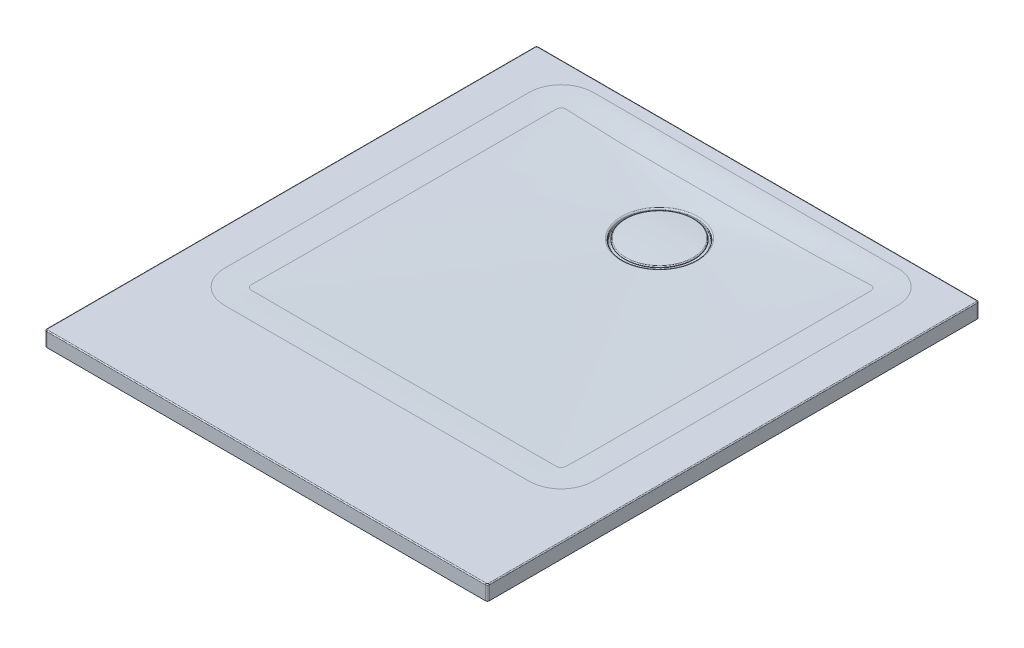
SolidWorks part; units mm, degrees
ref_plane "Płaszczyzna przednia" through (0, 0, 0) normal (0, 0, 1) x (1, 0, 0)
ref_plane "Płaszczyzna górna" through (0, 0, 0) normal (0, 1, 0) x (1, 0, 0)
ref_plane "Płaszczyzna prawa" through (0, 0, 0) normal (1, 0, 0) x (0, 0, -1)
sketch "Szkic2" plane through (0, 0, 0) normal (0, 1, 0) x (1, 0, 0)
  line L0 (0, 500) -> (0, 300) construction
  line L1 (-450, -500) -> (450, -500)
  line L2 (-450, -500) -> (-450, 500)
  line L3 (-450, 500) -> (450, 500)
  line L4 (450, -500) -> (450, 500)
  line L5 (-450, -500) -> (450, 500) construction
  line L6 (-450, 500) -> (450, -500) construction
  line L7 (-360, 460) -> (360, 460)
  line L8 (-360, 460) -> (-360, -260)
  line L9 (-360, -260) -> (360, -260)
  line L10 (360, 460) -> (360, -260)
  line L11 (-400, 500) -> (-400, -300) construction
  line L12 (-400, -300) -> (400, -300) construction
  line L13 (400, -300) -> (400, 500) construction
  circle A0 centre (0, 300) radius 75
  point P0 (0, 0)
  point P11 (0, 460)
  point P16 (0, -300)
  dimension "D9" = 150
  dimension "D1" = 900
  dimension "D2" = 1000
  dimension "D3" = 40
  dimension "D4" = 90
  dimension "D5" = 40
  dimension "D6" = 50
  dimension "D7" = 800
  dimension "D8" = 200
  dimension "D10" = 800
sketch "Szkic3" plane through (0, 0, 0) normal (0, 1, 0) x (1, 0, 0)
  line L0 (-450, -500) -> (-450, 500) construction
  line L1 (-450, -500) -> (450, -500) construction
  line L2 (450, -500) -> (450, 500) construction
  line L3 (-450, 500) -> (450, 500) construction
  line L4 (-360, 460) -> (-360, -260) construction
  line L5 (-360, 460) -> (360, 460) construction
  line L6 (360, 460) -> (360, -260) construction
  line L7 (-360, -260) -> (360, -260) construction
  line L8 (-450, -500) -> (-450, 500)
  line L9 (-450, -500) -> (450, -500)
  line L10 (450, -500) -> (450, 500)
  line L11 (-450, 500) -> (450, 500)
  line L12 (-360, 410) -> (-360, -210)
  line L13 (-310, 460) -> (310, 460)
  line L14 (360, 410) -> (360, -210)
  line L15 (-310, -260) -> (310, -260)
  arc A0 (360, 410) -> (310, 460) centre (310, 410) ccw
  arc A1 (-310, 460) -> (-360, 410) centre (-310, 410) ccw
  arc A2 (310, -260) -> (360, -210) centre (310, -210) ccw
  arc A3 (-310, -260) -> (-360, -210) centre (-310, -210) cw
  dimension "D1" = 50
surface "Powierzchnia-Płaszczyzna1" sketch "Szkic3"
sketch "Szkic4" plane through (0, 0, 0) normal (0, 1, 0) x (1, 0, 0)
  line L0 (-360, 460) -> (-360, -260) construction
  line L1 (-360, -260) -> (360, -260) construction
  line L2 (360, 460) -> (360, -260) construction
  line L3 (-360, 460) -> (360, 460) construction
  line L4 (-360, 460) -> (-360, -260)
  line L5 (-360, -260) -> (360, -260)
  line L6 (360, 460) -> (360, -260)
  line L7 (-360, 460) -> (360, 460)
ref_plane "korek" through (0, -15, 0) normal (0, 1, 0) x (-1, 0, 0)
sketch "Szkic5" plane through (0, -15, 0) normal (0, 1, 0) x (-1, 0, 0)
  circle A0 centre (0, -300) radius 75 construction
  circle A1 centre (0, -300) radius 75
surface "Powierzchnia-Wyciągnięcie po profilach2"
surface "Powierzchnia-Połącz1"
sketch "Szkic7" plane through (0, 0, 0) normal (0, 1, 0) x (1, 0, 0)
  line L27 (310, 420) -> (-310, 420)
  line L28 (-320, 410) -> (-320, -210)
  line L29 (-310, -220) -> (310, -220)
  line L30 (320, -210) -> (320, 410)
  line L31 (310, 420) -> (-310, 420)
  line L32 (-320, 410) -> (-320, -210)
  line L33 (-310, -220) -> (310, -220)
  line L34 (320, -210) -> (320, 410)
  line L35 (310, 475) -> (-310, 475)
  line L36 (-375, 410) -> (-375, -210)
  line L37 (-310, -275) -> (310, -275)
  line L38 (375, -210) -> (375, 410)
  line L39 (310, 475) -> (-310, 475)
  line L40 (-375, 410) -> (-375, -210)
  line L41 (-310, -275) -> (310, -275)
  line L42 (375, -210) -> (375, 410)
  arc A0 (320, -210) -> (310, -220) centre (310, -210) cw
  arc A1 (-320, -210) -> (-310, -220) centre (-310, -210) ccw
  arc A2 (320, 410) -> (310, 420) centre (310, 410) ccw
  arc A3 (-320, 410) -> (-310, 420) centre (-310, 410) cw
  spline S23 degree 3 poles (-642.4276, 138.4615) (143.2601, 308.8094) (326.8324, 376.6094) (319.7449, 412.2677) (319.6659, 412.5844) (319.4756, 413.2123) (319.364, 413.5244) (318.988, 414.4324) (318.6811, 415.0065) (318.1374, 415.8215) (317.9415, 416.0862) (317.5236, 416.5958) (317.3038, 416.8383) (316.6124, 417.53) (316.1095, 417.944) (315.2903, 418.4923) (315.0066, 418.6627) (314.4297, 418.9712) (314.1353, 419.1108) (313.5342, 419.3603) (313.2277, 419.4705) (312.6023, 419.661) (312.2821, 419.7415) (258.0026, 430.6172) (153.6608, -12.3452) (39.61, -542.7472) knots -6.791093 -6.791093 -6.791093 -6.791093 0.125 0.125 0.1875 0.1875 0.25 0.25 0.375 0.375 0.4375 0.4375 0.5 0.5 0.625 0.625 0.6875 0.6875 0.75 0.75 0.8125 0.8125 0.875 0.875 11.317642 11.317642 11.317642 11.317642 only from (320, 410) to (310, 420)
  spline S24 degree 3 poles (-31.4291, -540.4134) (-199.2409, 215.8714) (-274.2436, 427.3191) (-312.2675, 419.7448) (-312.5843, 419.6659) (-313.2122, 419.4758) (-313.5242, 419.3641) (-314.4322, 418.9882) (-315.0062, 418.6811) (-315.8212, 418.1376) (-316.0859, 417.9416) (-316.5956, 417.5238) (-316.838, 417.304) (-317.5298, 416.6127) (-317.9438, 416.1098) (-318.4921, 415.2908) (-318.6624, 415.007) (-318.9711, 414.4301) (-319.1106, 414.1356) (-319.3602, 413.5345) (-319.4703, 413.2278) (-319.6609, 412.6025) (-319.7416, 412.2823) (-328.6821, 367.5611) (-33.1297, 289.3562) (650.2866, 168.0792) knots -7.255081 -7.255081 -7.255081 -7.255081 0.125 0.125 0.1875 0.1875 0.25 0.25 0.375 0.375 0.4375 0.4375 0.5 0.5 0.625 0.625 0.6875 0.6875 0.75 0.75 0.8125 0.8125 0.875 0.875 9.466633 9.466633 9.466633 9.466633 only from (-310, 420) to (-320, 410)
  spline S25 degree 3 poles (642.4251, 61.5379) (-143.2606, -108.8096) (-326.8324, -176.6094) (-319.7449, -212.2677) (-319.6659, -212.5844) (-319.4756, -213.2123) (-319.364, -213.5244) (-318.988, -214.4324) (-318.6811, -215.0065) (-318.1374, -215.8215) (-317.9415, -216.0862) (-317.5236, -216.5958) (-317.3038, -216.8383) (-316.6124, -217.53) (-316.1095, -217.944) (-315.2903, -218.4923) (-315.0066, -218.6627) (-314.4297, -218.9712) (-314.1353, -219.1108) (-313.5342, -219.3603) (-313.2277, -219.4705) (-312.6023, -219.661) (-312.2821, -219.7415) (-258.0027, -230.6172) (-153.661, 212.3443) (-39.6103, 742.7457) knots -6.791085 -6.791085 -6.791085 -6.791085 0.125 0.125 0.1875 0.1875 0.25 0.25 0.375 0.375 0.4375 0.4375 0.5 0.5 0.625 0.625 0.6875 0.6875 0.75 0.75 0.8125 0.8125 0.875 0.875 11.317632 11.317632 11.317632 11.317632 only from (-320, -210) to (-310, -220)
  spline S26 degree 3 poles (31.4291, 740.4136) (199.2409, -15.8714) (274.2436, -227.3191) (312.2675, -219.7448) (312.5843, -219.6659) (313.2122, -219.4758) (313.5242, -219.3641) (314.4322, -218.9882) (315.0062, -218.6811) (315.8212, -218.1376) (316.0859, -217.9416) (316.5956, -217.5238) (316.838, -217.304) (317.5298, -216.6127) (317.9438, -216.1098) (318.4921, -215.2908) (318.6624, -215.007) (318.9711, -214.4301) (319.1106, -214.1356) (319.3602, -213.5345) (319.4703, -213.2278) (319.6609, -212.6025) (319.7416, -212.2823) (328.6821, -167.5611) (33.1297, -89.3562) (-650.2867, 31.9209) knots -7.255081 -7.255081 -7.255081 -7.255081 0.125 0.125 0.1875 0.1875 0.25 0.25 0.375 0.375 0.4375 0.4375 0.5 0.5 0.625 0.625 0.6875 0.6875 0.75 0.75 0.8125 0.8125 0.875 0.875 9.466633 9.466633 9.466633 9.466633 only from (310, -220) to (320, -210)
  spline S31 degree 3 poles (-2447.3279, -564.9037) (-187.9384, -11.1134) (406.24, 259.1285) (373.3422, 424.7391) (372.8283, 426.7975) (371.9013, 429.8585) (371.5657, 430.8761) (370.8439, 432.8947) (370.4595, 433.8909) (368.4227, 438.8085) (366.4282, 442.5403) (363.4834, 446.9548) (362.8716, 447.825) (361.6017, 449.5398) (360.9418, 450.3866) (358.9049, 452.8707) (357.4759, 454.4469) (352.9823, 458.9436) (349.7133, 461.6344) (345.2769, 464.6047) (344.3695, 465.1805) (342.535, 466.2817) (341.6076, 466.8075) (338.7954, 468.3123) (336.881, 469.219) (332.9737, 470.8414) (330.9809, 471.5575) (327.9321, 472.4866) (326.9059, 472.7721) (324.8332, 473.2939) (323.7848, 473.5304) (320.636, 474.1598) (318.525, 474.4739) (157.1945, 490.4271) (-66.7497, -76.4225) (-486.2095, -2402.8106) knots -4.799088 -4.799088 -4.799088 -4.799088 0.125 0.125 0.1875 0.1875 0.21875 0.21875 0.25 0.25 0.375 0.375 0.40625 0.40625 0.4375 0.4375 0.5 0.5 0.625 0.625 0.65625 0.65625 0.6875 0.6875 0.75 0.75 0.8125 0.8125 0.84375 0.84375 0.875 0.875 0.9375 0.9375 5.625508 5.625508 5.625508 5.625508 only from (375, 410) to (310, 475)
  spline S32 degree 3 poles (607.9599, -2368.1366) (53.2635, 27.3408) (-172.0764, 488.9143) (-318.4946, 474.4775) (-320.5876, 474.167) (-324.7389, 473.3421) (-326.7973, 472.8284) (-329.8583, 471.9015) (-330.8758, 471.5658) (-332.8944, 470.844) (-333.8907, 470.4596) (-338.8083, 468.4228) (-342.54, 466.4283) (-346.9545, 463.4835) (-347.8248, 462.8718) (-349.5396, 461.6019) (-350.3863, 460.9421) (-352.8705, 458.9052) (-354.4466, 457.4761) (-358.9434, 452.9826) (-361.6341, 449.7136) (-364.6045, 445.2774) (-365.1802, 444.3699) (-366.2814, 442.5354) (-366.8073, 441.6079) (-368.3122, 438.7958) (-369.2188, 436.8813) (-370.8414, 432.9739) (-371.5573, 430.9811) (-372.4865, 427.9323) (-372.7721, 426.9061) (-373.2939, 424.8334) (-373.5304, 423.785) (-412.5492, 228.5137) (443.2833, -65.1095) (2470.5411, -488.8872) knots -4.211101 -4.211101 -4.211101 -4.211101 0.0625 0.0625 0.125 0.125 0.1875 0.1875 0.21875 0.21875 0.25 0.25 0.375 0.375 0.40625 0.40625 0.4375 0.4375 0.5 0.5 0.625 0.625 0.65625 0.65625 0.6875 0.6875 0.75 0.75 0.8125 0.8125 0.84375 0.84375 0.875 0.875 6.657374 6.657374 6.657374 6.657374 only from (-310, 475) to (-375, 410)
  spline S33 degree 3 poles (2447.3279, 764.9037) (187.9384, 211.1134) (-406.24, -59.1285) (-373.3422, -224.7391) (-372.8283, -226.7975) (-371.9013, -229.8585) (-371.5657, -230.8761) (-370.8439, -232.8947) (-370.4595, -233.8909) (-368.4227, -238.8085) (-366.4282, -242.5403) (-363.4834, -246.9548) (-362.8716, -247.825) (-361.6017, -249.5398) (-360.9418, -250.3866) (-358.9049, -252.8707) (-357.4759, -254.4469) (-352.9823, -258.9436) (-349.7133, -261.6344) (-345.2769, -264.6047) (-344.3695, -265.1805) (-342.535, -266.2817) (-341.6076, -266.8075) (-338.7954, -268.3123) (-336.881, -269.219) (-332.9737, -270.8414) (-330.9809, -271.5575) (-327.9321, -272.4866) (-326.9059, -272.7721) (-324.8332, -273.2939) (-323.7848, -273.5304) (-320.636, -274.1598) (-318.525, -274.4739) (-157.1945, -290.4271) (66.7497, 276.4225) (486.2095, 2602.8106) knots -4.799088 -4.799088 -4.799088 -4.799088 0.125 0.125 0.1875 0.1875 0.21875 0.21875 0.25 0.25 0.375 0.375 0.40625 0.40625 0.4375 0.4375 0.5 0.5 0.625 0.625 0.65625 0.65625 0.6875 0.6875 0.75 0.75 0.8125 0.8125 0.84375 0.84375 0.875 0.875 0.9375 0.9375 5.625508 5.625508 5.625508 5.625508 only from (-375, -210) to (-310, -275)
  spline S34 degree 3 poles (-607.9599, 2568.1367) (-53.2635, 172.6592) (172.0764, -288.9143) (318.4946, -274.4775) (320.5876, -274.167) (324.7389, -273.3421) (326.7973, -272.8284) (329.8583, -271.9015) (330.8758, -271.5658) (332.8944, -270.844) (333.8907, -270.4596) (338.8083, -268.4228) (342.54, -266.4283) (346.9545, -263.4835) (347.8248, -262.8718) (349.5396, -261.6019) (350.3863, -260.9421) (352.8705, -258.9052) (354.4466, -257.4761) (358.9434, -252.9826) (361.6341, -249.7136) (364.6045, -245.2774) (365.1802, -244.3699) (366.2814, -242.5354) (366.8073, -241.6079) (368.3122, -238.7958) (369.2188, -236.8813) (370.8414, -232.9739) (371.5573, -230.9811) (372.4865, -227.9323) (372.7721, -226.9061) (373.2939, -224.8334) (373.5304, -223.785) (412.5492, -28.5137) (-443.2833, 265.1095) (-2470.5412, 688.8872) knots -4.211101 -4.211101 -4.211101 -4.211101 0.0625 0.0625 0.125 0.125 0.1875 0.1875 0.21875 0.21875 0.25 0.25 0.375 0.375 0.40625 0.40625 0.4375 0.4375 0.5 0.5 0.625 0.625 0.65625 0.65625 0.6875 0.6875 0.75 0.75 0.8125 0.8125 0.84375 0.84375 0.875 0.875 6.657374 6.657374 6.657374 6.657374 only from (310, -275) to (375, -210)
  spline S35 degree 3 poles (375, 410) (375, 414.2918) (374.5792, 418.512) (373.3422, 424.7391) (372.8283, 426.7975) (371.9013, 429.8585) (371.5657, 430.8761) (370.8439, 432.8947) (370.4595, 433.8909) (368.4227, 438.8085) (366.4282, 442.5403) (363.4834, 446.9548) (362.8716, 447.825) (361.6017, 449.5398) (360.9418, 450.3866) (358.9049, 452.8707) (357.4759, 454.4469) (352.9823, 458.9436) (349.7133, 461.6344) (345.2769, 464.6047) (344.3695, 465.1805) (342.535, 466.2817) (341.6076, 466.8075) (338.7954, 468.3123) (336.881, 469.219) (332.9737, 470.8414) (330.9809, 471.5575) (327.9321, 472.4866) (326.9059, 472.7721) (324.8332, 473.2939) (323.7848, 473.5304) (320.636, 474.1598) (318.525, 474.4739) (314.2799, 474.8937) (312.1459, 475) (310, 475) knots 0 0 0 0 0.125 0.125 0.1875 0.1875 0.21875 0.21875 0.25 0.25 0.375 0.375 0.40625 0.40625 0.4375 0.4375 0.5 0.5 0.625 0.625 0.65625 0.65625 0.6875 0.6875 0.75 0.75 0.8125 0.8125 0.84375 0.84375 0.875 0.875 0.9375 0.9375 1 1 1 1
  spline S36 degree 3 poles (-310, 475) (-312.1459, 475) (-314.2737, 474.8937) (-318.4946, 474.4775) (-320.5876, 474.167) (-324.7389, 473.3421) (-326.7973, 472.8284) (-329.8583, 471.9015) (-330.8758, 471.5658) (-332.8944, 470.844) (-333.8907, 470.4596) (-338.8083, 468.4228) (-342.54, 466.4283) (-346.9545, 463.4835) (-347.8248, 462.8718) (-349.5396, 461.6019) (-350.3863, 460.9421) (-352.8705, 458.9052) (-354.4466, 457.4761) (-358.9434, 452.9826) (-361.6341, 449.7136) (-364.6045, 445.2774) (-365.1802, 444.3699) (-366.2814, 442.5354) (-366.8073, 441.6079) (-368.3122, 438.7958) (-369.2188, 436.8813) (-370.8414, 432.9739) (-371.5573, 430.9811) (-372.4865, 427.9323) (-372.7721, 426.9061) (-373.2939, 424.8334) (-373.5304, 423.785) (-374.5791, 418.5368) (-375, 414.2918) (-375, 410) knots 0 0 0 0 0.0625 0.0625 0.125 0.125 0.1875 0.1875 0.21875 0.21875 0.25 0.25 0.375 0.375 0.40625 0.40625 0.4375 0.4375 0.5 0.5 0.625 0.625 0.65625 0.65625 0.6875 0.6875 0.75 0.75 0.8125 0.8125 0.84375 0.84375 0.875 0.875 1 1 1 1
  spline S37 degree 3 poles (-375, -210) (-375, -214.2918) (-374.5792, -218.512) (-373.3422, -224.7391) (-372.8283, -226.7975) (-371.9013, -229.8585) (-371.5657, -230.8761) (-370.8439, -232.8947) (-370.4595, -233.8909) (-368.4227, -238.8085) (-366.4282, -242.5403) (-363.4834, -246.9548) (-362.8716, -247.825) (-361.6017, -249.5398) (-360.9418, -250.3866) (-358.9049, -252.8707) (-357.4759, -254.4469) (-352.9823, -258.9436) (-349.7133, -261.6344) (-345.2769, -264.6047) (-344.3695, -265.1805) (-342.535, -266.2817) (-341.6076, -266.8075) (-338.7954, -268.3123) (-336.881, -269.219) (-332.9737, -270.8414) (-330.9809, -271.5575) (-327.9321, -272.4866) (-326.9059, -272.7721) (-324.8332, -273.2939) (-323.7848, -273.5304) (-320.636, -274.1598) (-318.525, -274.4739) (-314.2799, -274.8937) (-312.1459, -275) (-310, -275) knots 0 0 0 0 0.125 0.125 0.1875 0.1875 0.21875 0.21875 0.25 0.25 0.375 0.375 0.40625 0.40625 0.4375 0.4375 0.5 0.5 0.625 0.625 0.65625 0.65625 0.6875 0.6875 0.75 0.75 0.8125 0.8125 0.84375 0.84375 0.875 0.875 0.9375 0.9375 1 1 1 1
  spline S38 degree 3 poles (310, -275) (312.1459, -275) (314.2737, -274.8937) (318.4946, -274.4775) (320.5876, -274.167) (324.7389, -273.3421) (326.7973, -272.8284) (329.8583, -271.9015) (330.8758, -271.5658) (332.8944, -270.844) (333.8907, -270.4596) (338.8083, -268.4228) (342.54, -266.4283) (346.9545, -263.4835) (347.8248, -262.8718) (349.5396, -261.6019) (350.3863, -260.9421) (352.8705, -258.9052) (354.4466, -257.4761) (358.9434, -252.9826) (361.6341, -249.7136) (364.6045, -245.2774) (365.1802, -244.3699) (366.2814, -242.5354) (366.8073, -241.6079) (368.3122, -238.7958) (369.2188, -236.8813) (370.8414, -232.9739) (371.5573, -230.9811) (372.4865, -227.9323) (372.7721, -226.9061) (373.2939, -224.8334) (373.5304, -223.785) (374.5791, -218.5368) (375, -214.2918) (375, -210) knots 0 0 0 0 0.0625 0.0625 0.125 0.125 0.1875 0.1875 0.21875 0.21875 0.25 0.25 0.375 0.375 0.40625 0.40625 0.4375 0.4375 0.5 0.5 0.625 0.625 0.65625 0.65625 0.6875 0.6875 0.75 0.75 0.8125 0.8125 0.84375 0.84375 0.875 0.875 1 1 1 1
  dimension "D3" = 10
  dimension "D1" = 40
  dimension "D2" = 15
other "Usuń ścianę1"
other "Granica-Powierzchnia1"
surface "Powierzchnia-Połącz2"
sketch "Szkic9" plane through (0, 0, 0) normal (0, 1, 0) x (1, 0, 0)
  line L0 (-450, -500) -> (450, -500) construction
  line L1 (-450, -500) -> (-450, 500) construction
  line L2 (450, -500) -> (450, 500) construction
  line L3 (-450, 500) -> (450, 500) construction
  line L4 (-450, -500) -> (450, -500)
  line L5 (-450, -500) -> (-450, 500)
  line L6 (450, -500) -> (450, 500)
  line L7 (-450, 500) -> (450, 500)
surface "Powierzchnia-Wyciągnięcie1" sketch "Szkic9" parameters "D1"=30
sketch "Szkic8" plane through (0, 0, 0) normal (1, 0, 0) x (0, 0, -1)
  line L0 (300, 0) -> (300, -30) construction
  line L1 (224.9999, -15) -> (225.2968, -23.5)
  line L4 (225.2968, -23.5) -> (248, -24.0945)
  line L5 (225.2968, -23.5) -> (300, -23.5) construction
  line L6 (248, -24.0945) -> (248, -30) construction
  line L7 (300, -30) -> (225.2968, -30) construction
  line L8 (225.2968, -30) -> (225.2968, -23.5) construction
  line L9 (255, -28) -> (255, -30)
  line L10 (248, -24.0945) -> (255, -28)
  dimension "D1" = 30
  dimension "D2" = 8.5
  dimension "D3" = 2
  dimension "D4" = 1.5
  dimension "D5" = 52
  dimension "D6" = 45
  dimension "D7" = 2
surface "Powierzchnia-Obrót1" sketch "Szkic8" parameters "D1"=360
surface "Powierzchnia-Płaszczyzna2"
surface "Powierzchnia-Połącz3"
fillet "Zaokrąglenie4" radius 4 4 edges at (-450, -15, -500) (450, -15, -500) (-450, -15, 500) (450, -15, 500)
fillet "Zaokrąglenie5" radius 3 3 edges at (0, -24.0945, -352) (0, -23.5, -374.7032)
fillet "Zaokrąglenie6" radius 2 9 edges at (448.8284, 0, 498.8284) (0, 0, 500) (-448.8284, 0, 498.8284) (-450, 0, 0) (-448.8284, 0, -498.8284) (0, 0, -500) (448.8284, 0, -498.8284) (450, 0, 0) (0, -28, -345)
sketch "Szkic11" plane through (0, 0, 0) normal (1, 0, 0) x (0, 0, -1)
  line L0 (300, 0) -> (300, -30) construction
  line L1 (-496, -30) -> (496, -30) construction
  line L2 (300, -17) -> (300, -11.5)
  line L14 (370, -11.5) -> (370, -14.5) construction
  line L16 (370, -17) -> (300, -17)
  line L18 (370, -17) -> (370, -16.3377)
  line L19 (300, -11.5) -> (370, -11.5) construction
  arc A0 (370, -16.3377) -> (368.1666, -14.3446) centre (368, -16.3377) ccw
  arc A6 (368.1666, -14.3446) -> (300, -11.5) centre (300, -829.6667) ccw
  dimension "D2" = 2
  dimension "D8" = 2.5
  dimension "D9" = 17
  dimension "D10" = 5.5
  dimension "D11" = 70
revolve "Obrót1" add sketch "Szkic11" angle 360 about L0
